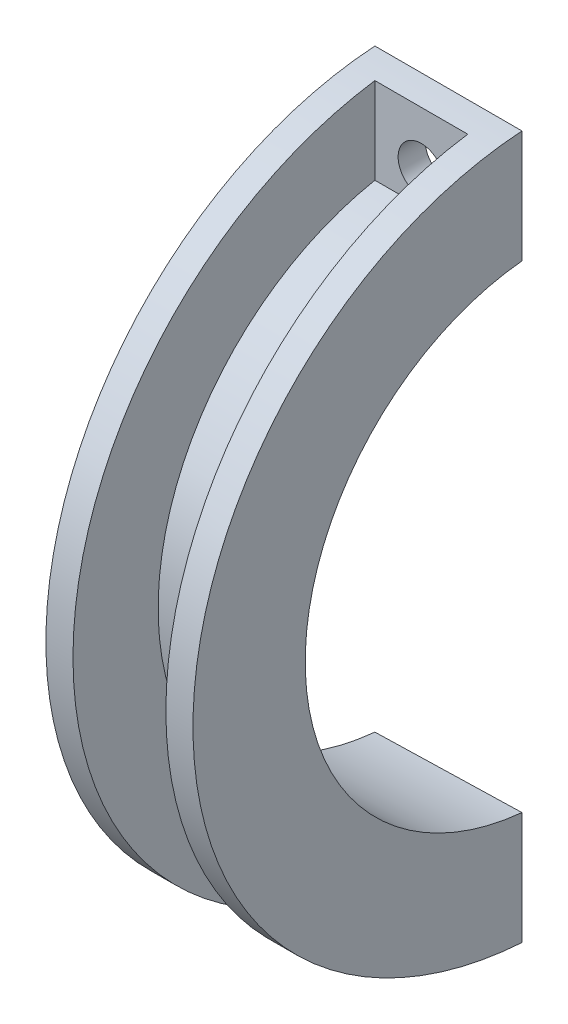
SolidWorks part; units mm, degrees
ref_plane "Plan1" through (0, 0, 0) normal (0, 0, 1) x (1, 0, 0)
ref_plane "Plan2" through (0, 0, 0) normal (0, 1, 0) x (1, 0, 0)
ref_plane "Plan3" through (0, 0, 0) normal (1, 0, 0) x (0, 0, -1)
sketch "Esquisse2" plane through (0, 0, 3) normal (0, 0, 1) x (1, 0, 0)
  line L0 (589.5217, 0) -> (551.8432, 0) construction
  line L1 (578.0768, 31) -> (578.0768, 45.5)
  line L2 (578.0768, 45.5) -> (559.0768, 45.5)
  line L3 (578.0768, 31) -> (559.0768, 31.4975)
  line L4 (559.0768, 45.5) -> (559.0768, 31.4975)
  line L5 (578.0768, -30.8545) -> (578.0768, 30.8545) construction
  line L6 (543.1968, 0) -> (545.2377, 0) construction
  dimension "D1" = 45.5
  dimension "D2" = 1.5
  dimension "D3" = 19
  dimension "D4" = 31
revolve "Base-Révolution" add sketch "Esquisse2" angle 180 about L0
ref_plane "Plan4" through (568.5768, 0, 0) normal (-1, 0, 0) x (0, 0, 1)
sketch "Esquisse3" plane through (568.5768, 0, 0) normal (-1, 0, 0) x (0, 0, 1)
  line L0 (0, 0) -> (58, 0) construction
  line L2 (9.5, -33.8821) -> (9.5, -45.0333)
  line L4 (9.5, 33.8821) -> (9.5, 45.0333)
  arc A1 (9.5, -33.8821) -> (9.5, 33.8821) centre (3, 0) ccw
  dimension "D1" = 34.5
  dimension "D2" = 6.5
extrude "Enlèv. de mat.-Extru.-Mince1" cut sketch "Esquisse3" against normal mid plane 12 thin
sketch "Esquisse5" plane through (0, 0, 3) normal (0, 0, -1) x (-1, 0, 0)
  line L0 (-538.8248, 0) -> (-585.5439, 0) construction
  line L1 (-588.0768, 0) -> (-493.0768, 0) construction
  line L2 (-574.5768, 0) -> (-562.5768, 0) construction
  circle A0 centre (-568.5768, 38) radius 3
  circle A1 centre (-568.5768, 38) radius 2 construction
  circle A2 centre (-568.5768, -38) radius 3
  dimension "D1" = 6
extrude "Enlèv. mat.-Extru.2" cut sketch "Esquisse5" against normal through all
sketch "Esquisse6" plane through (0, 0, 3) normal (0, 0, -1) x (-1, 0, 0)
  circle A0 centre (-563.5768, 0) radius 1.5 construction
  circle A1 centre (-563.5768, 0) radius 1.5
extrude "Enlèv. mat.-Extru.3" cut sketch "Esquisse6" against normal blind 33
sketch "Esquisse7" plane through (559.0768, 0, 0) normal (-1, 0, 0) x (0, 0, 1)
  line L0 (6, 50) -> (6, -50)
  line L1 (6, 19.7737) -> (6, 31.3543) construction
extrude "Enlèv. mat.-Extru.5" cut sketch "Esquisse7" against normal through all and the other way through all flip side to cut
